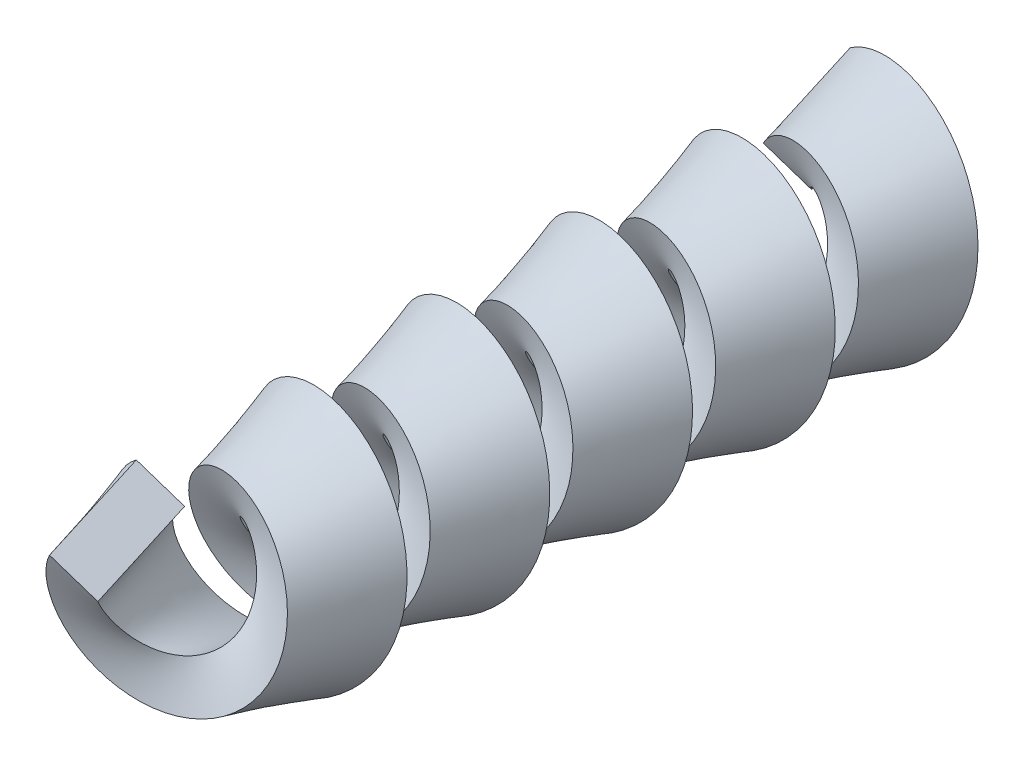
SolidWorks part; units mm, degrees
ref_plane "Ebene vorne" through (0, 0, 0) normal (0, 0, 1) x (1, 0, 0)
ref_plane "Ebene oben" through (0, 0, 0) normal (0, 1, 0) x (1, 0, 0)
ref_plane "Ebene rechts" through (0, 0, 0) normal (1, 0, 0) x (0, 0, -1)
sketch "Skizze1" plane through (0, 0, 0) normal (0, 0, 1) x (1, 0, 0)
  circle A0 centre (0, 0) radius 37.5
  dimension "D1" = 75
curve "Spirale/Helix1"
ref_plane "Ebene1" through (-26.5165, 26.5165, 0) normal (0.6738, 0.6738, 0.3033) x (-0.7389, 0.6144, 0.2766)
sketch "Skizze2" plane through (-26.5165, 26.5165, 0) normal (0.6738, 0.6738, 0.3033) x (-0.7389, 0.6144, 0.2766)
  line L1 (-12.5, -25) -> (12.5, -25)
  line L2 (-12.5, -25) -> (-12.5, 25)
  line L3 (-12.5, 25) -> (12.5, 25)
  line L4 (12.5, -25) -> (12.5, 25)
  line L5 (-12.5, -25) -> (12.5, 25) construction
  line L6 (-12.5, 25) -> (12.5, -25) construction
  point P0 (0, 0)
  dimension "D1" = 25
  dimension "D2" = 50
sweep "Austragung1" add profiles "Skizze2" path "Spirale/Helix1"
